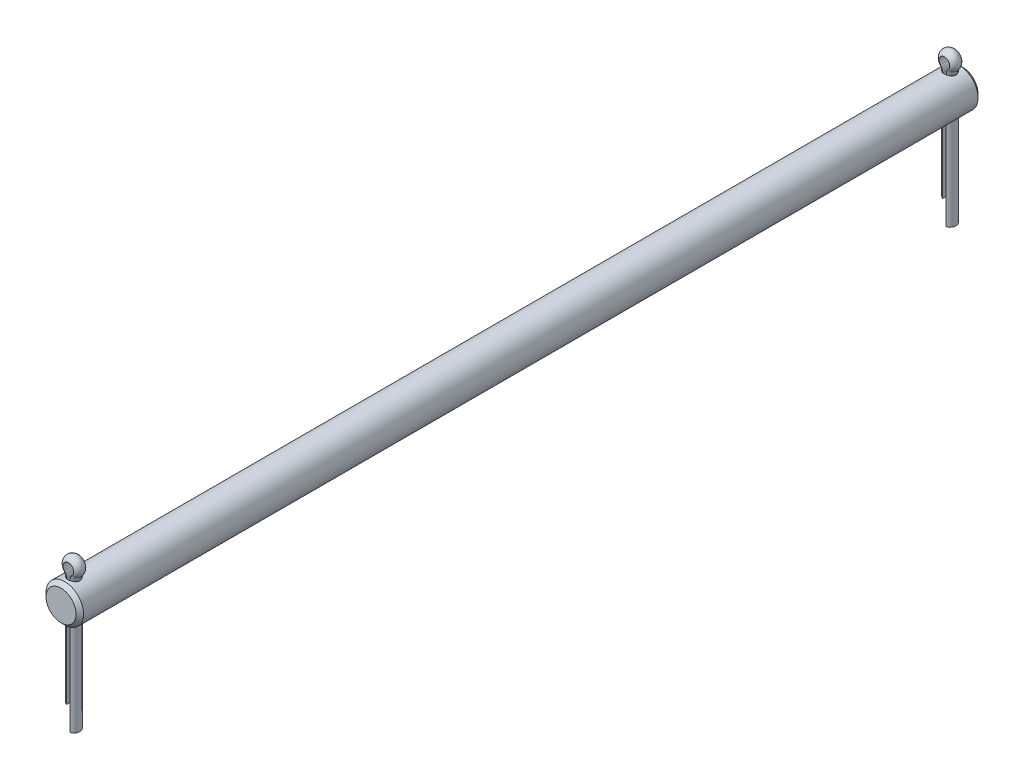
SolidWorks part; units mm, degrees
ref_plane "Front" through (0, 0, 0) normal (0, 0, 1) x (1, 0, 0)
ref_plane "Top" through (0, 0, 0) normal (0, 1, 0) x (1, 0, 0)
ref_plane "Right" through (0, 0, 0) normal (1, 0, 0) x (0, 0, -1)
sketch "Sketch2" plane through (0, 0, 0) normal (0, 0, 1) x (1, 0, 0)
  circle A0 centre (0, 0) radius 6.35
  point P3 (0, 6.35)
  point P4 (0, -6.35)
extrude "Extrude1" add sketch "Sketch2" along normal mid plane 304.8
sketch "Sketch3" plane through (0, 0, 0) normal (0, 1, 0) x (1, 0, 0)
  line L0 (0, 146.05) -> (0, -146.05) construction
  circle A0 centre (0, -148.0344) radius 1.9844
  circle A1 centre (0, 148.0344) radius 1.9844
  point P6 (-1.9844, -148.0344)
  point P8 (1.9844, -148.0344)
  point P9 (0, -150.0188)
  point P10 (0, 150.0188)
extrude "Extrude2" cut sketch "Sketch3" against normal through all and the other way through all
ref_plane "Plane1" through (0, 0, 148.0344) normal (0, 0, 1) x (1, 0, 0)
sketch "Sketch4" plane through (0, 0, 148.0344) normal (0, 0, 1) x (1, 0, 0)
  line L0 (1.9844, -38.1249) -> (1.9844, 6.35)
  line L1 (-1.9844, 6.35) -> (-1.9844, -30.5049)
  arc A0 (2.3812, 7.4) -> (-2.3812, 7.4) centre (0, 9.5001) ccw
  arc A1 (-2.3812, 7.4) -> (-1.9844, 6.35) centre (-3.5719, 6.35) cw
  arc A2 (1.9844, 6.35) -> (2.3812, 7.4) centre (3.5719, 6.35) cw
  point P7 (0, 12.6751)
chamfer "Chamfer1" distance 1.27 angle 45 2 edges at (6.35, 0, -152.4) (6.35, 0, 152.4)
ref_plane "Plane2" through (1.9844, -38.1249, 148.0344) normal (0, 1, 0) x (-1, 0, 0)
sketch "Sketch5" plane through (1.9844, -38.1249, 148.0344) normal (0, 1, 0) x (-1, 0, 0)
  line L0 (1.3891, 1.893) -> (1.3891, -1.893)
  circle A0 centre (1.9844, 0) radius 1.9844 construction
  arc A1 (1.3891, 1.893) -> (1.3891, -1.893) centre (1.9844, 0) ccw
  point P2 (0, 0)
sweep "Sweep1" add profiles "Sketch5" path "Sketch4"
mirror "Mirror1" about plane through (0, 0, 0) normal (0, 0, 1)
sketch "Sketch6" plane through (0, 0, 0) normal (1, 0, 0) x (0, 0, -1)
  line L1 (-152.4, 5.08) -> (-152.4, -5.08) construction
  line L2 (152.4, -5.08) -> (152.4, 5.08) construction
  point P0 (-146.05, 12.6751)
  point P1 (146.05, 12.6751)
  point P2 (-152.4, 6.35)
  point P6 (152.4, 6.35)
  point P7 (152.4, -6.35)
  point P8 (-152.4, -6.35)
equation "\"D1@Chamfer1\" = \"dia@Sketch2\" * .1"
equation "\"D1@Sketch5\" = \"hole dia@Sketch3\" * .35"
equation "\"D1@Sketch4\" = \"hole dia@Sketch3\" * 1.6"
equation "\"D3@Sketch4\" = \"D1@Sketch4\" * .5"
equation "\"D2@Sketch4\" = \"pin lg@Sketch4\" * .15"
